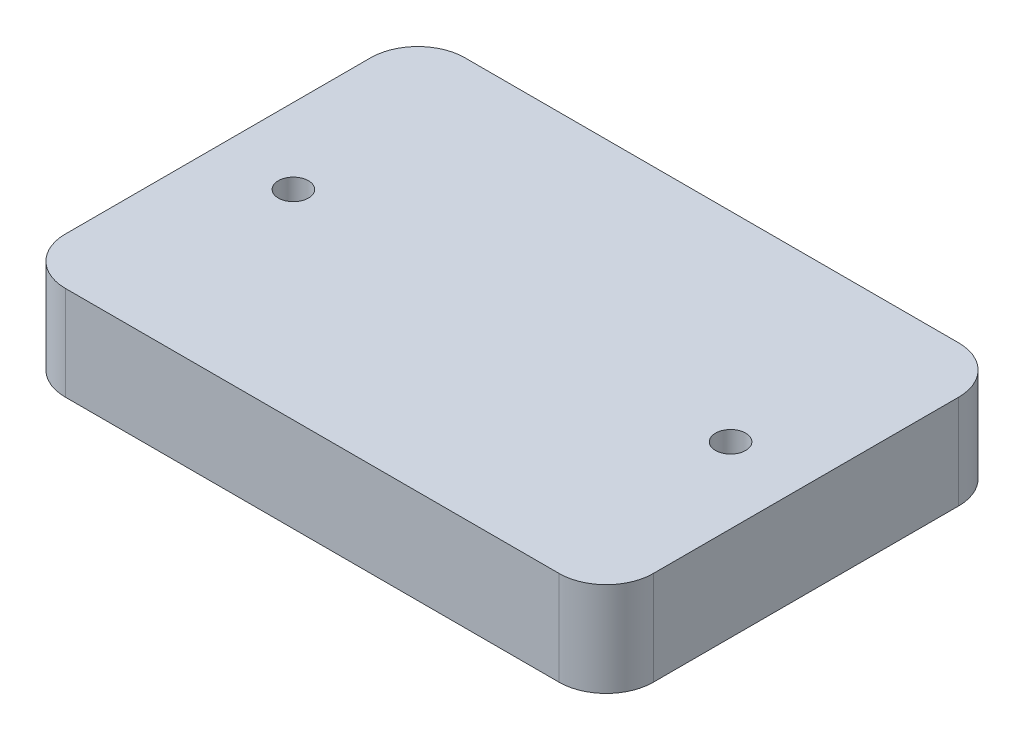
SolidWorks part; units mm, degrees
ref_plane "Plan de face" through (0, 0, 0) normal (0, 0, 1) x (1, 0, 0)
ref_plane "Plan de dessus" through (0, 0, 0) normal (0, 1, 0) x (1, 0, 0)
ref_plane "Plan de droite" through (0, 0, 0) normal (1, 0, 0) x (0, 0, -1)
sketch "Esquisse1" plane through (0, 0, 0) normal (0, 1, 0) x (1, 0, 0)
  line L0 (-5, 38.2659) -> (-5, -24.3481) construction
  line L1 (0, 0) -> (52.5, 0) construction
  line L2 (0, 0) -> (0, 32.4) construction
  line L3 (0, 32.4) -> (52.5, 32.4) construction
  line L4 (52.5, 0) -> (52.5, 32.4) construction
  line L5 (-9.6666, -5) -> (81.5983, -5) construction
  line L6 (-9.6666, 37.4) -> (81.5983, 37.4) construction
  line L7 (57.4, -24.3481) -> (57.4, 38.2659) construction
  line L8 (67.7518, 16.2) -> (-18.4622, 16.2) construction
  line L9 (26.2, -17.4684) -> (26.2, -1.4448) construction
  line L10 (3, 26.6836) -> (3, 11.6179) construction
  line L12 (0, 37.4) -> (52.4, 37.4)
  line L13 (-5, 32.4) -> (-5, 0)
  line L14 (0, -5) -> (52.4, -5)
  line L15 (57.4, 32.4) -> (57.4, 0)
  circle A0 centre (3, 16.2) radius 1.6
  circle A1 centre (49.4, 16.2) radius 1.6
  arc A2 (52.4, 37.4) -> (57.4, 32.4) centre (52.4, 32.4) cw
  arc A3 (52.4, -5) -> (57.4, 0) centre (52.4, 0) ccw
  arc A4 (-5, 0) -> (0, -5) centre (0, 0) ccw
  arc A5 (0, 37.4) -> (-5, 32.4) centre (0, 32.4) ccw
  point P32 (57.4, -5)
  point P37 (-5, 37.4)
  dimension "D8" = 5
  dimension "D1" = 62.4
  dimension "D2" = 42.4
  dimension "D3" = 5
  dimension "D4" = 5
  dimension "D5" = 21.2
  dimension "D6" = 31.2
  dimension "D7" = 3
extrude "Boss.-Extru.1" add sketch "Esquisse1" along normal blind 10
